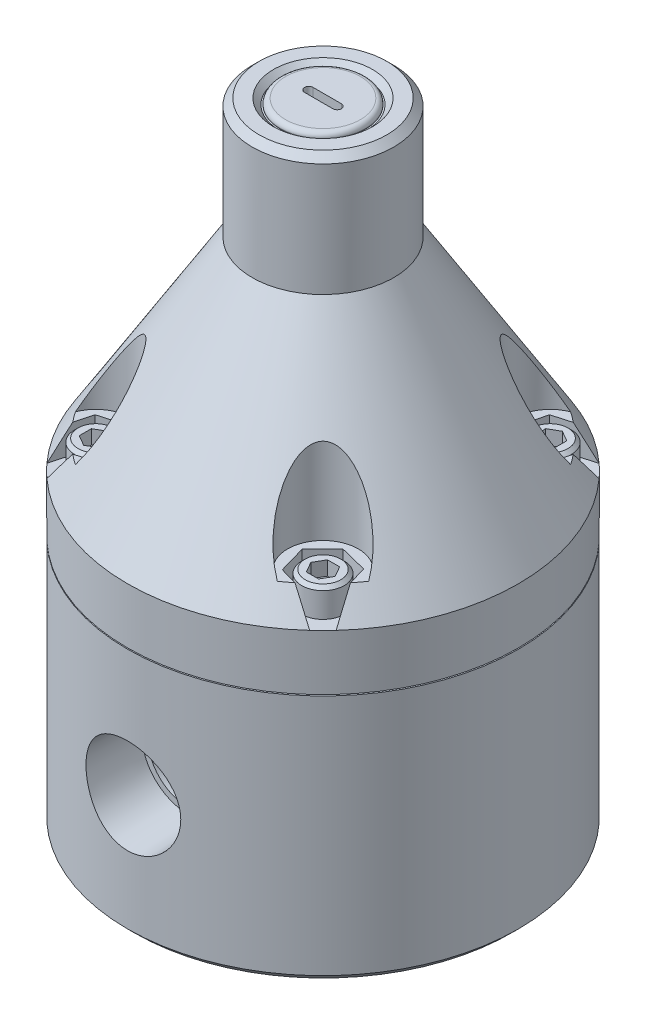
SolidWorks part; units mm, degrees
ref_plane "Front Plane" through (0, 0, 0) normal (0, 0, 1) x (1, 0, 0)
ref_plane "Top Plane" through (0, 0, 0) normal (0, 1, 0) x (1, 0, 0)
ref_plane "Right Plane" through (0, 0, 0) normal (1, 0, 0) x (0, 0, -1)
sketch "Sketch1" plane through (0, 0, 0) normal (0, 1, 0) x (1, 0, 0)
  circle A0 centre (0, 0) radius 43.815
  dimension "D1" = 87.63
extrude "Extrude1" add sketch "Sketch1" along normal blind 140.97
sketch "Sketch2" plane through (0, 0, 0) normal (0, 0, 1) x (1, 0, 0)
  line L0 (0, 0) -> (0, 140.97) construction
  line L1 (43.815, 140.97) -> (-43.815, 140.97) construction
  line L2 (-43.815, 56.134) -> (-43.815, 68.58)
  line L3 (-43.815, 56.134) -> (-30.226, 56.134)
  line L4 (-30.226, 56.134) -> (-30.226, 55.88)
  line L6 (-30.226, 55.88) -> (-49.4473, 55.88)
  line L7 (-49.4473, 55.88) -> (-49.4473, 147.034)
  line L8 (-49.4473, 147.034) -> (-15.875, 147.034)
  line L9 (-15.875, 147.034) -> (-15.875, 114.046)
  line L10 (-15.875, 114.046) -> (-43.815, 68.58)
  line L12 (-43.815, 0) -> (43.815, 0) construction
  dimension "D1" = 43.815
  dimension "D2" = 55.88
  dimension "D3" = 0.254
  dimension "D4" = 30.226
  dimension "D5" = 15.875
  dimension "D6" = 68.58
  dimension "D7" = 26.924
revolve "Cut-Revolve1" cut sketch "Sketch2" angle 360 about L0
ref_plane "Plane1" through (0, 140.97, 0) normal (0, 1, 0) x (-1, 0, 0)
sketch "Sketch3" plane through (0, 140.97, 0) normal (0, 1, 0) x (-1, 0, 0)
  circle A0 centre (0, 0) radius 11.1125
  dimension "D1" = 22.225
extrude "Extrude2" cut sketch "Sketch3" against normal blind 1.27 draft 45
chamfer "Chamfer1" distance 1.5748 angle 45 2 edges at (0, 0, 43.815) (0, 140.97, 15.875)
sketch "Sketch4" plane through (0, 140.97, 0) normal (0, 1, 0) x (-1, 0, 0)
  circle A0 centre (0, 0) radius 9.525
  dimension "D1" = 19.05
extrude "Extrude3" add sketch "Sketch4" against normal up to surface (1.27 mm away)
fillet "Fillet1" radius 1.143 1 edges at (0, 140.97, 9.525)
sketch "Sketch5" plane through (0, 140.97, 0) normal (0, 1, 0) x (-1, 0, 0)
  line L0 (-3.175, 0) -> (3.175, 0) construction
  line L1 (3.175, 0.9652) -> (-3.175, 0.9652)
  line L2 (-3.175, -0.9652) -> (3.175, -0.9652)
  arc A0 (-3.175, 0.9652) -> (-3.175, -0.9652) centre (-3.175, 0) ccw
  arc A1 (3.175, -0.9652) -> (3.175, 0.9652) centre (3.175, 0) ccw
  dimension "D1" = 3.175
  dimension "D2" = 6.35
  dimension "D3" = 0.9652
  dimension "D4" = 0.9652
extrude "Extrude4" cut sketch "Sketch5" against normal blind 3.302 draft 1
ref_plane "Plane2" through (0, 74.93, 0) normal (0, 1, 0) x (-1, 0, 0)
sketch "Sketch6" plane through (0, 74.93, 0) normal (0, 1, 0) x (-1, 0, 0)
  line L0 (0, 0) -> (-43.815, 0) construction
  line L1 (0, 0) -> (-30.9819, 30.9819) construction
  circle A0 centre (0, 0) radius 43.815 construction
  circle A1 centre (0, 0) radius 36.0045 construction
  circle A2 centre (-25.459, 25.459) radius 7.9375
  dimension "D1" = 72.009
  dimension "D2" = 15.875
extrude "Extrude5" cut sketch "Sketch6" along normal blind 22.86
sketch "Sketch8" plane through (0, 74.93, 0) normal (0, 1, 0) x (-1, 0, 0)
  line L0 (0, 0) -> (-30.9819, 30.9819) construction
  line L1 (-30.9819, 19.758) -> (-19.9362, 31.1601) construction
  line L2 (-30.9819, 30.9819) -> (-39.3973, 39.3973) construction
  line L3 (-29.9486, 20.8246) -> (-23.6903, 19.2537)
  line L4 (-23.6903, 19.2537) -> (-19.2007, 23.8882)
  line L5 (-19.2007, 23.8882) -> (-20.9694, 30.0935)
  line L9 (-29.9486, 20.8246) -> (-33.5917, 33.5917)
  line L10 (-33.5917, 33.5917) -> (-20.9694, 30.0935)
  line L12 (-27.2278, 31.6643) -> (-31.7174, 27.0299)
  line L13 (-20.9694, 30.0935) -> (-27.2278, 31.6643)
  line L14 (-31.7174, 27.0299) -> (-29.9486, 20.8246)
  circle A0 centre (0, 0) radius 43.815 construction
  arc A1 (-32.876, 22.6318) -> (-22.6318, 32.876) centre (-25.459, 25.459) ccw construction
  arc A2 (-32.876, 22.6318) -> (-22.6318, 32.876) centre (-25.459, 25.459) ccw construction
  circle A3 centre (-25.459, 25.459) radius 5.588 construction
extrude "Extrude6" cut sketch "Sketch8" against normal blind 6.35
pattern_circular "CirPattern1" count 4 over 360 about axis through (0, 0, 0) along (0, 1, 0) of "Extrude5", "Extrude6"
sketch "Sketch9" plane through (0, 74.93, 0) normal (0, 1, 0) x (-1, 0, 0)
  line L0 (0, 0) -> (-25.459, 25.459) construction
  circle A0 centre (-25.459, 25.459) radius 4.7625
  dimension "D1" = 9.525
extrude "Extrude7" add sketch "Sketch9" against normal up to surface (6.35 mm away)
sketch "Sketch10" plane through (0, 74.93, 0) normal (0, 1, 0) x (-1, 0, 0)
  line L1 (-28.1871, 25.459) -> (-26.8231, 23.0964)
  line L2 (-26.8231, 23.0964) -> (-24.095, 23.0964)
  line L3 (-24.095, 23.0964) -> (-22.7309, 25.459)
  line L4 (-22.7309, 25.459) -> (-24.095, 27.8216)
  line L5 (-24.095, 27.8216) -> (-26.8231, 27.8216)
  line L6 (-26.8231, 27.8216) -> (-28.1871, 25.459)
  circle A0 centre (-25.459, 25.459) radius 2.3626 construction
extrude "Extrude8" cut sketch "Sketch10" against normal blind 3.175
pattern_circular "CirPattern2" count 4 over 360 about axis through (0, 0, 0) along (0, 1, 0) of "Extrude7", "Extrude8"
chamfer "Chamfer2" distance 0.762 angle 45 4 edges at (-25.459, 74.93, -30.2215) (30.2215, 74.93, -25.459) (25.459, 74.93, 30.2215) (-30.2215, 74.93, 25.459)
ref_plane "Plane3" through (0, 0, 43.815) normal (0, 0, 1) x (1, 0, 0)
sketch "Sketch11" plane through (0, 0, 43.815) normal (0, 0, 1) x (1, 0, 0)
  line L0 (0, -6.7756) -> (0, 147.7456) construction
  line L1 (-48.3989, 25.4) -> (47.2148, 25.4) construction
  line L2 (-42.2402, 0) -> (42.2402, 0) construction
  dimension "D1" = 25.4
hole_wizard "1/2 NPT Tapped Hole4" positions "3DSketch3" profile "Sketch14" size "1/2" standard "Ansi Inch"
sketch3d "3DSketch3"
  line L0 (0, -6.7756, 43.815) -> (0, 147.7456, 43.815) construction
  point P0 (0, 27.432, 43.815)
sketch "Sketch14" plane through (0, 27.432, 43.815) normal (1, 0, 0) x (0, -1, 0)
  line L0 (0, 0) -> (0, 20.2081)
  line L1 (8.9281, 16.51) -> (0, 20.2081)
  line L2 (-8.9281, 16.51) -> (0, 20.2081) construction
  line L3 (8.9281, 16.51) -> (8.9281, 13.462)
  line L4 (8.9281, 13.462) -> (10.2617, 13.462)
  line L5 (10.2617, 13.462) -> (10.6647, 0)
  line L6 (-10.2617, 13.462) -> (-10.6647, 0) construction
  line L7 (10.6647, 0) -> (0, 0)
  line L8 (0, -6.35) -> (0, 107.95) construction
  line L11 (-8.9281, 13.462) -> (-10.2617, 13.462) construction
  dimension "Tap Drill Dia." = 17.8562
  dimension "Tap Drill Depth" = 16.51
  dimension "Thread Dia." = 21.3295
  dimension "Thread Angle" = 3.43
  dimension "Thread Depth" = 13.462
  dimension "Drill Angle" = 135
mirror "Mirror1" about plane through (0, 0, 0) normal (0, 0, 1) of "1/2 NPT Tapped Hole4"
